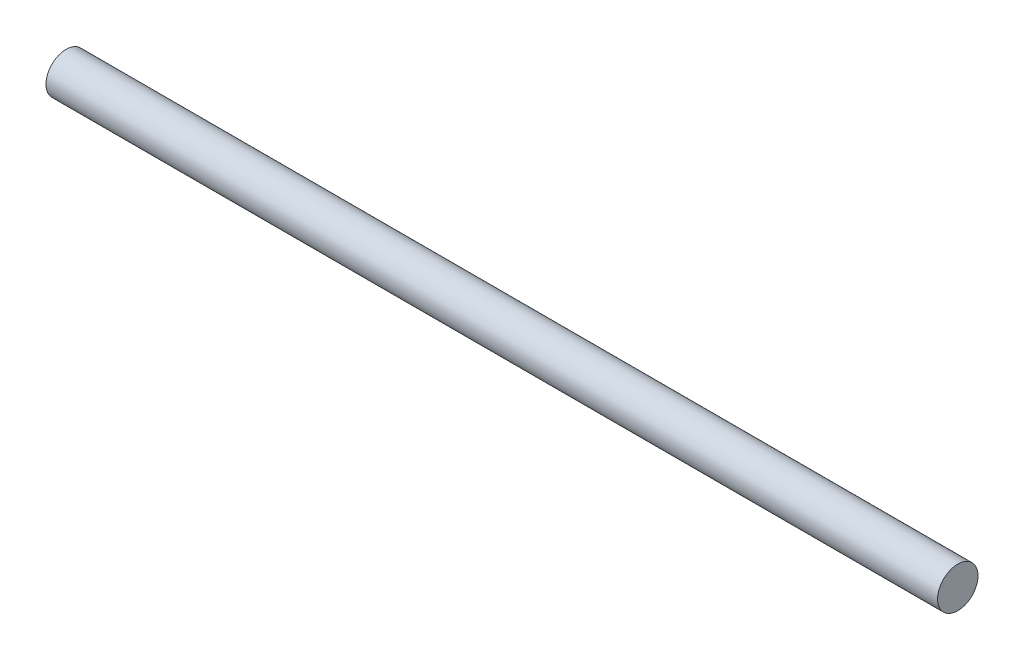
SolidWorks part; units mm, degrees
ref_plane "Front Plane" through (0, 0, 0) normal (0, 0, 1) x (1, 0, 0)
ref_plane "Top Plane" through (0, 0, 0) normal (0, 1, 0) x (1, 0, 0)
ref_plane "Right Plane" through (0, 0, 0) normal (1, 0, 0) x (0, 0, -1)
sketch "Sketch1" plane through (0, 0, 0) normal (1, 0, 0) x (0, 0, -1)
  circle A0 centre (0, 0) radius 3.175
  dimension "D1" = 6.35
extrude "Boss-Extrude1" add sketch "Sketch1" along normal blind 140
